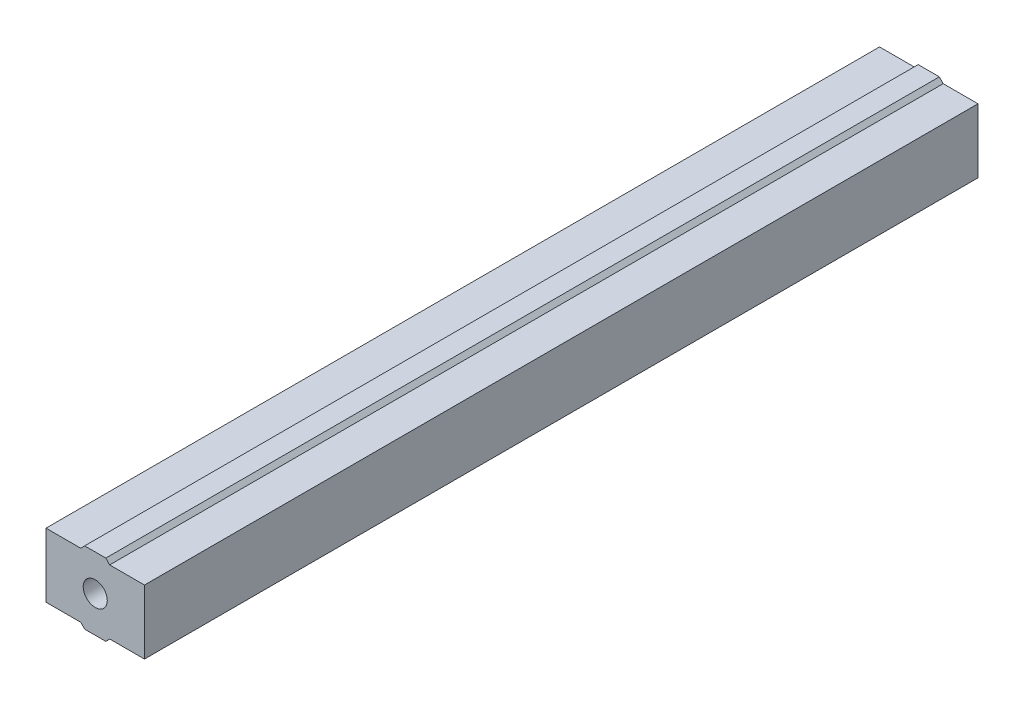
SolidWorks part; units mm, degrees
ref_plane "Front Plane" through (0, 0, 0) normal (0, 0, 1) x (1, 0, 0)
ref_plane "Top Plane" through (0, 0, 0) normal (0, 1, 0) x (1, 0, 0)
ref_plane "Right Plane" through (0, 0, 0) normal (1, 0, 0) x (0, 0, -1)
sketch "Sketch1" plane through (0, 0, 0) normal (0, 0, 1) x (1, 0, 0)
  line L24 (-19.4945, -12.7) -> (-5.715, -12.7)
  line L25 (-5.715, -12.7) -> (-4.191, -14.2875)
  line L26 (-4.191, -14.2875) -> (4.191, -14.2875)
  line L27 (4.191, -14.2875) -> (5.715, -12.7)
  line L28 (5.715, -12.7) -> (19.4945, -12.7)
  line L29 (19.4945, -12.7) -> (19.4945, 12.7)
  line L30 (19.4945, 12.7) -> (5.715, 12.7)
  line L31 (5.715, 12.7) -> (4.191, 14.2875)
  line L32 (4.191, 14.2875) -> (-4.191, 14.2875)
  line L33 (-4.191, 14.2875) -> (-5.715, 12.7)
  line L34 (-5.715, 12.7) -> (-19.4945, 12.7)
  line L35 (-19.4945, 12.7) -> (-19.4945, -12.7)
  circle A1 centre (0, 0) radius 4.7625
extrude "Extrude1" add sketch "Sketch1" along normal blind 330
